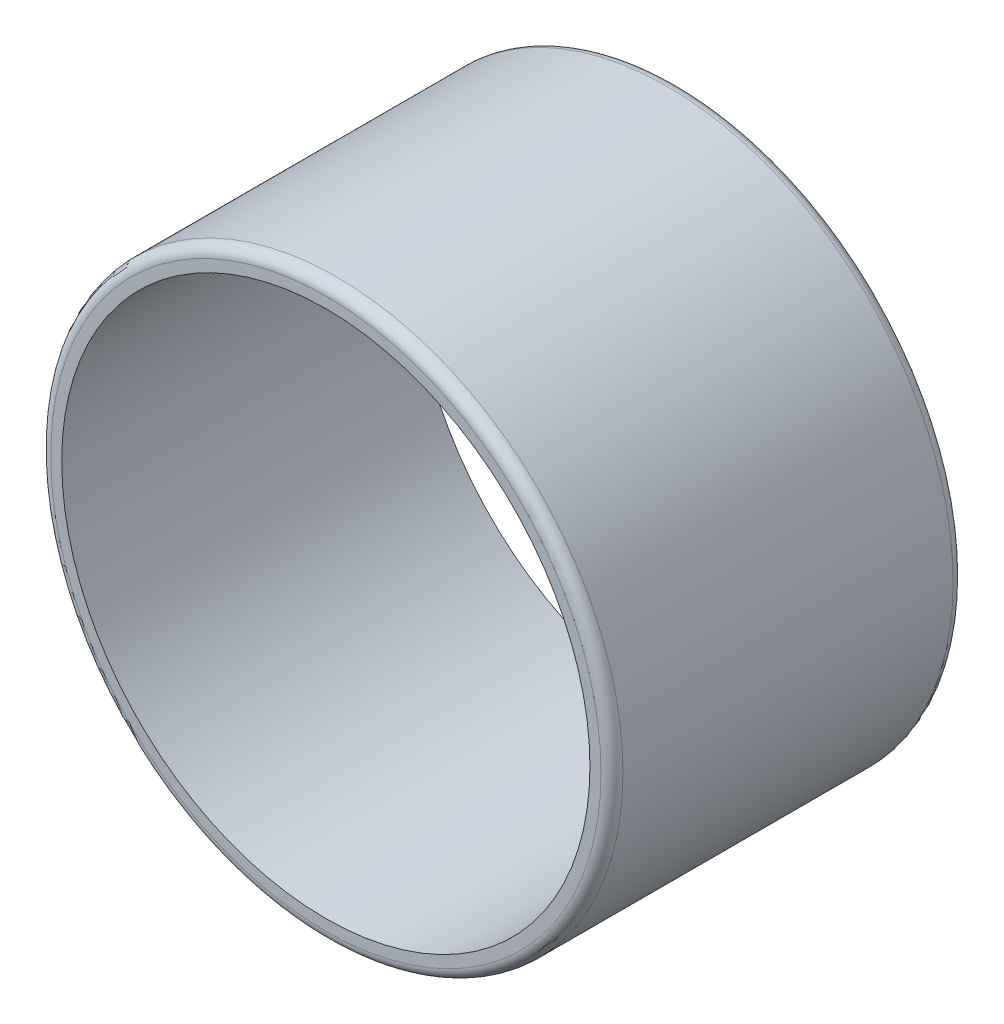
SolidWorks part; units mm, degrees
ref_plane "Face" through (0, 0, 0) normal (0, 0, 1) x (1, 0, 0)
ref_plane "Dessus" through (0, 0, 0) normal (0, 1, 0) x (1, 0, 0)
ref_plane "Droite" through (0, 0, 0) normal (1, 0, 0) x (0, 0, -1)
sketch "Esquisse1" plane through (0, 0, 0) normal (0, 0, 1) x (1, 0, 0)
  circle A0 centre (0, 0) radius 12
  circle A1 centre (0, 0) radius 13
  dimension "D1" = 24
  dimension "D2" = 26
extrude "Extrusion1" add sketch "Esquisse1" along normal mid plane 16
fillet "Congé1" radius 0.5
